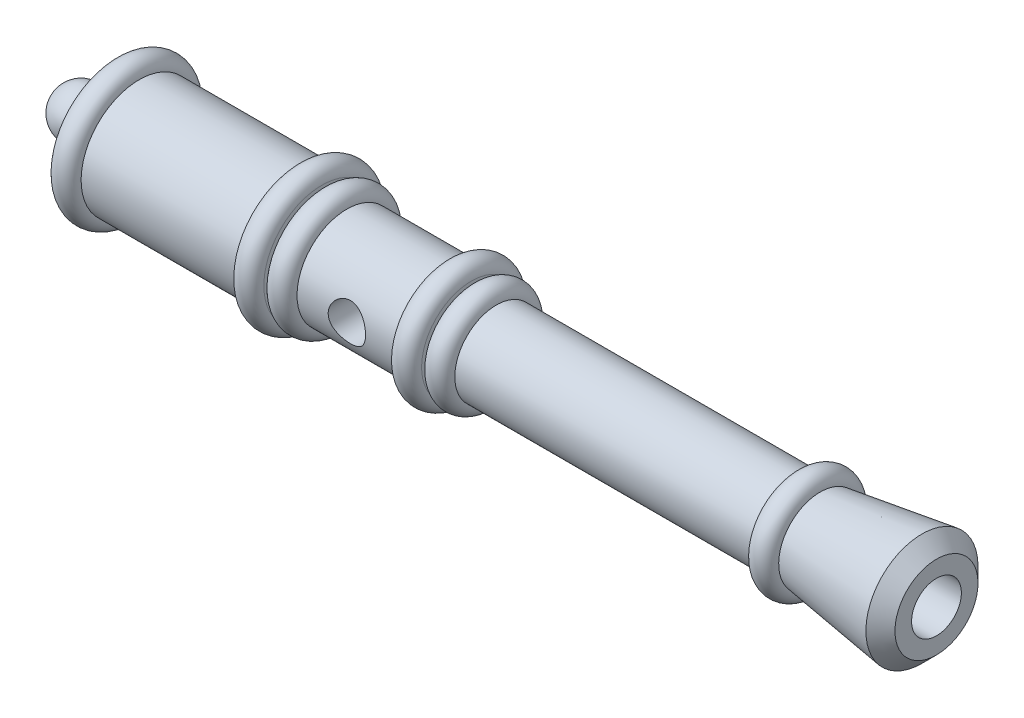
SolidWorks part; units mm, degrees
ref_plane "Front" through (0, 0, 0) normal (0, 0, 1) x (1, 0, 0)
ref_plane "Top" through (0, 0, 0) normal (0, 1, 0) x (1, 0, 0)
ref_plane "Right" through (0, 0, 0) normal (1, 0, 0) x (0, 0, -1)
sketch "Sketch1" plane through (0, 0, 0) normal (0, 0, 1) x (1, 0, 0)
  line L0 (0, 0) -> (96.2679, 0)
  line L1 (106, 3) -> (106, 7)
  line L2 (53, 5) -> (89, 5)
  line L3 (10, 7) -> (29, 7)
  line L4 (98, 3) -> (106, 3)
  line L5 (50, 5) -> (50, 6)
  line L7 (98, 3) -> (96.2679, 0)
  line L8 (32, 6) -> (32, 7)
  line L14 (35, 6) -> (47, 6)
  line L29 (92, 5) -> (106, 7)
  arc A0 (92, 5) -> (89, 5) centre (90.5, 5) ccw
  arc A1 (53, 5) -> (50, 5) centre (51.5, 5) ccw
  arc A2 (50, 6) -> (47, 6) centre (48.5, 6) ccw
  arc A3 (35, 6) -> (32, 6) centre (33.5, 6) ccw
  arc A4 (32, 7) -> (29, 7) centre (30.5, 7) ccw
  arc A5 (10, 7) -> (7, 7) centre (8.5, 7) ccw
  arc A6 (4, 2.8284) -> (0, 0) centre (3, 0) ccw
  arc A9 (4, 2.8284) -> (7, 7) centre (3, 6.7121) ccw
revolve "Revolve1" add sketch "Sketch1" angle 360 about L0
chamfer "Chamfer1" distance 2 angle 45 1 edges at (106, -7, 0)
sketch "Sketch3" plane through (0, 0, 0) normal (0, 0, 1) x (1, 0, 0)
  circle A0 centre (41, 0) radius 2.25
extrude "Cut-Extrude1" cut sketch "Sketch3" against normal mid plane 20
